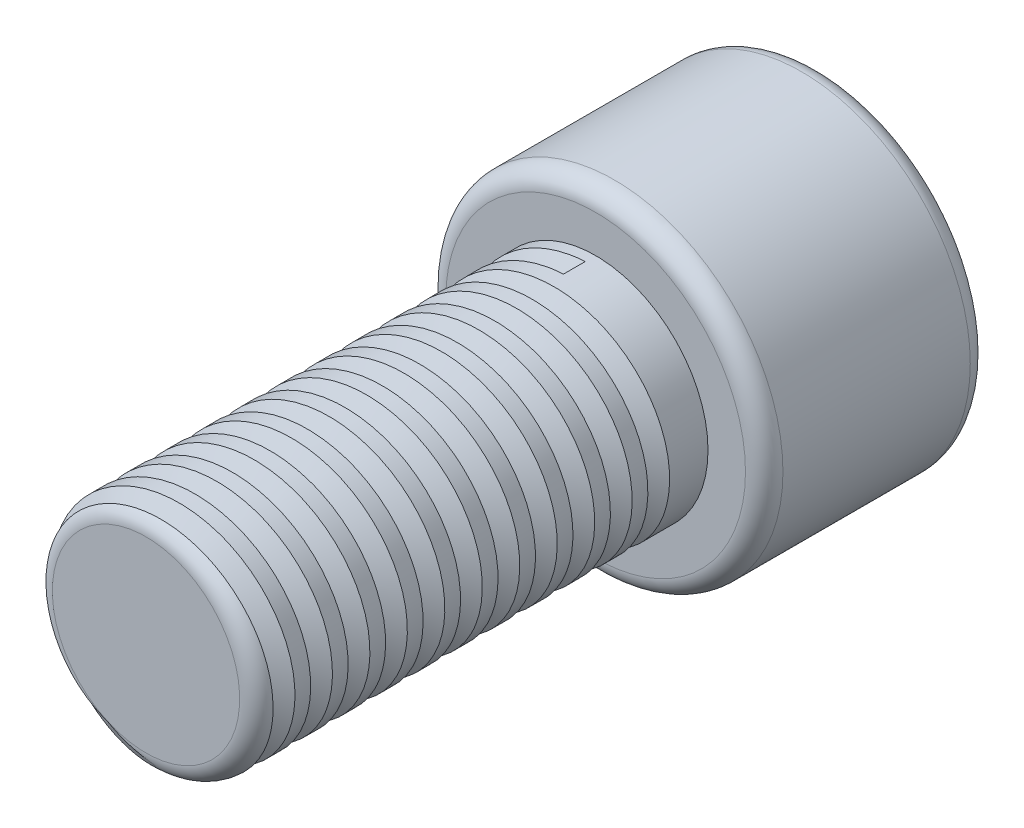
SolidWorks part; units mm, degrees
ref_plane "前视基准面" through (0, 0, 0) normal (0, 0, 1) x (1, 0, 0)
ref_plane "上视基准面" through (0, 0, 0) normal (0, 1, 0) x (1, 0, 0)
ref_plane "右视基准面" through (0, 0, 0) normal (1, 0, 0) x (0, 0, -1)
sketch "草图1" plane through (0, 0, 0) normal (0, 0, 1) x (1, 0, 0)
  circle A0 centre (0, 0) radius 4.5
extrude "凸台-拉伸1" add sketch "草图1" along normal blind 6
sketch "草图2" plane through (0, 0, 6) normal (0, 0, 1) x (1, 0, 0)
  circle A0 centre (0, 0) radius 3
extrude "凸台-拉伸2" add sketch "草图2" along normal blind 12
sketch "草图3" plane through (0, 0, 0) normal (0, 0, -1) x (-1, 0, 0)
  line L1 (2.8868, 0) -> (1.4434, 2.5)
  line L2 (1.4434, 2.5) -> (-1.4434, 2.5)
  line L3 (-1.4434, 2.5) -> (-2.8868, 0)
  line L4 (-2.8868, 0) -> (-1.4434, -2.5)
  line L5 (-1.4434, -2.5) -> (1.4434, -2.5)
  line L6 (1.4434, -2.5) -> (2.8868, 0)
  circle A0 centre (0, 0) radius 2.5 construction
  dimension "D1" = 5
extrude "切除-拉伸1" cut sketch "草图3" against normal blind 5
fillet "圆角1" radius 0.5 3 edges at (3, 0, 18) (4.5, 0, 6) (4.5, 0, 0)
sketch "草图4" plane through (0, 0, 18) normal (0, 0, 1) x (1, 0, 0)
  circle A0 centre (0, 0) radius 2.5
curve "螺旋线/涡状线1"
sketch "草图5" plane through (0, 0, 0) normal (0, 1, 0) x (1, 0, 0)
  line L0 (2.4972, -15.7425) -> (2.4972, -18.6075) construction
  line L2 (2.4972, -18.3188) -> (3.0801, -18.6553)
  line L3 (3.0801, -18.6553) -> (3.0801, -17.9822)
  line L4 (3.0801, -17.9822) -> (2.4972, -18.3188)
  circle A0 centre (2.8858, -18.3188) radius 0.1943 construction
  spline S0 degree 3 number of poles 195 (0, -18) -> (0, -6) construction
sweep "切除-扫描1" cut profiles "草图5" path "螺旋线/涡状线1"
